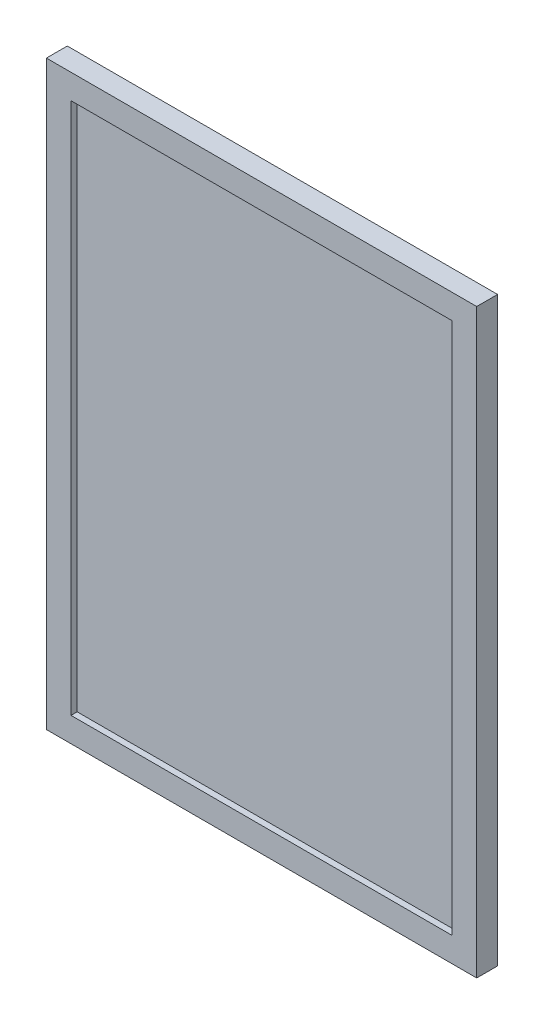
SolidWorks part; units mm, degrees
ref_plane "Plan de face" through (0, 0, 0) normal (0, 0, 1) x (1, 0, 0)
ref_plane "Plan de dessus" through (0, 0, 0) normal (0, 1, 0) x (1, 0, 0)
ref_plane "Plan de droite" through (0, 0, 0) normal (1, 0, 0) x (0, 0, -1)
sketch "Esquisse1" plane through (0, 0, 0) normal (0, 0, 1) x (1, 0, 0)
  line L1 (0, 0) -> (350, 0)
  line L2 (0, 0) -> (0, 473)
  line L3 (0, 473) -> (350, 473)
  line L4 (350, 0) -> (350, 473)
  dimension "D1" = 473
  dimension "D2" = 350
extrude "Boss.-Extru.1" add sketch "Esquisse1" along normal blind 17
sketch "Esquisse2" plane through (0, 0, 0) normal (0, 0, -1) x (-1, 0, 0)
  line L0 (-350, 0) -> (-350, 473) construction
  line L1 (-330, 453) -> (-20, 453)
  line L2 (-330, 453) -> (-330, 20)
  line L3 (-330, 20) -> (-20, 20)
  line L4 (-20, 453) -> (-20, 20)
  line L5 (0, 473) -> (0, 0) construction
  line L6 (-350, 473) -> (0, 473) construction
  line L7 (0, 0) -> (-350, 0) construction
  dimension "D1" = 20
  dimension "D2" = 20
  dimension "D3" = 20
  dimension "D4" = 20
extrude "Enlèv. mat.-Extru.1" cut sketch "Esquisse2" against normal blind 5
sketch "Esquisse3" plane through (0, 0, 17) normal (0, 0, 1) x (1, 0, 0)
  line L0 (0, 473) -> (0, 0) construction
  line L1 (20, 453) -> (330, 453)
  line L2 (20, 453) -> (20, 20)
  line L3 (20, 20) -> (330, 20)
  line L4 (330, 453) -> (330, 20)
  line L5 (350, 0) -> (350, 473) construction
  line L6 (350, 473) -> (0, 473) construction
  line L7 (0, 0) -> (350, 0) construction
  dimension "D1" = 20
  dimension "D2" = 20
  dimension "D3" = 20
  dimension "D4" = 20
extrude "Enlèv. mat.-Extru.2" cut sketch "Esquisse3" against normal blind 5
